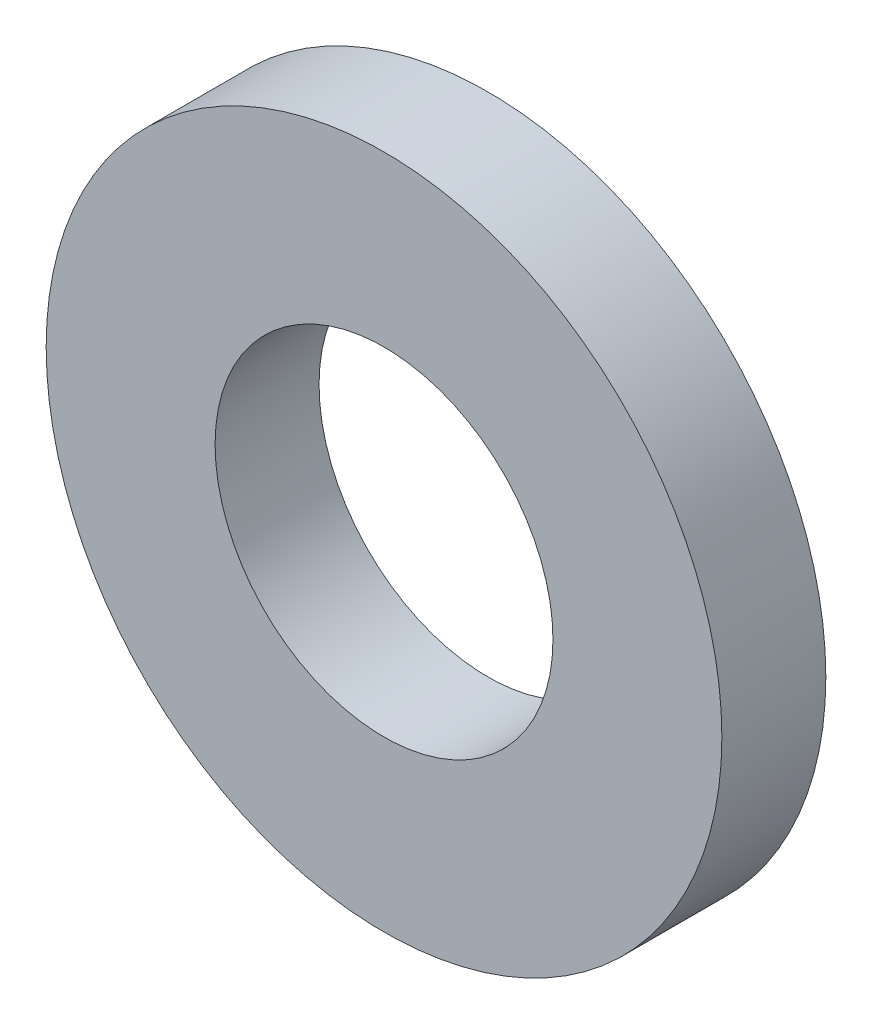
SolidWorks part; units mm, degrees
ref_plane "Face" through (0, 0, 0) normal (0, 0, 1) x (1, 0, 0)
ref_plane "Dessus" through (0, 0, 0) normal (0, 1, 0) x (1, 0, 0)
ref_plane "Droite" through (0, 0, 0) normal (1, 0, 0) x (0, 0, -1)
sketch "Esquisse1" plane through (0, 0, 0) normal (0, 0, 1) x (1, 0, 0)
  circle A0 centre (0, 0) radius 3.25
  circle A1 centre (0, 0) radius 6.5
  dimension "D1" = 6.5
  dimension "D2" = 13
extrude "Base-Extrusion" add sketch "Esquisse1" along normal blind 2
